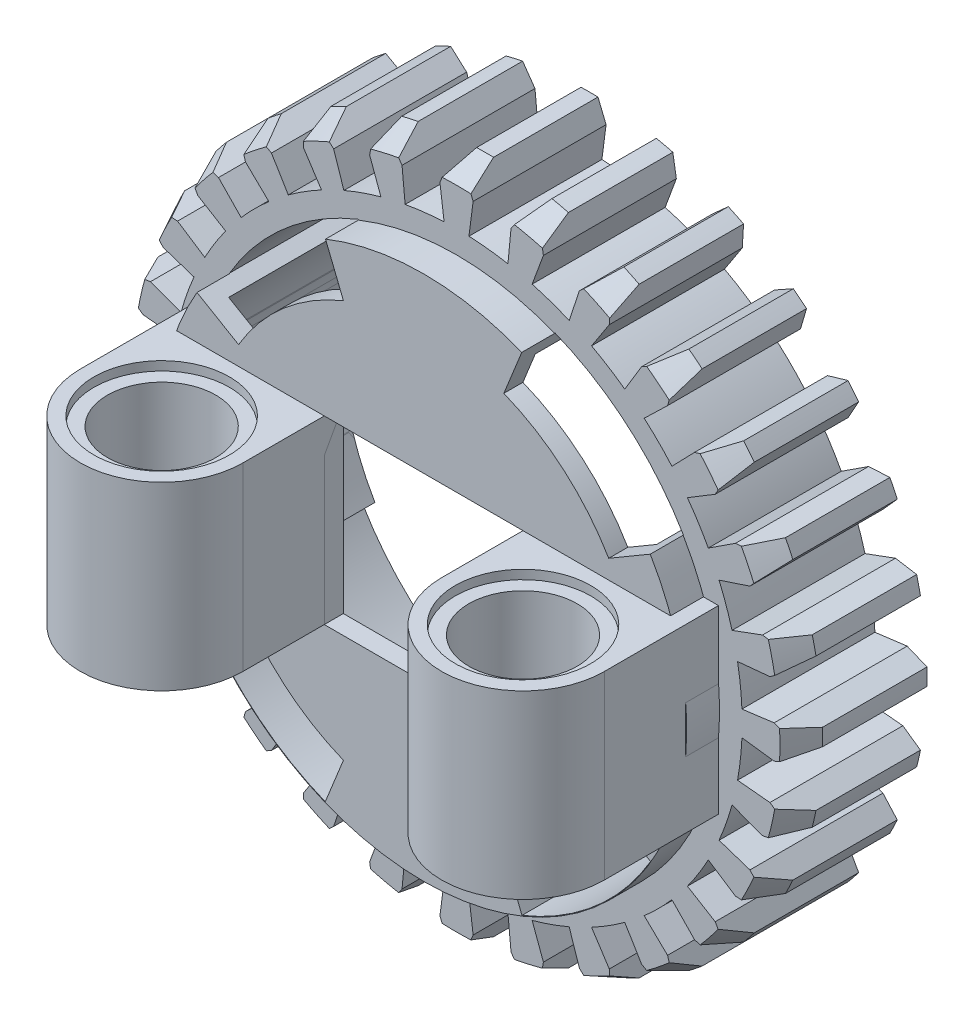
SolidWorks part; units mm, degrees
ref_plane "정면" through (0, 0, 0) normal (0, 0, 1) x (1, 0, 0)
ref_plane "윗면" through (0, 0, 0) normal (0, 1, 0) x (1, 0, 0)
ref_plane "우측면" through (0, 0, 0) normal (1, 0, 0) x (0, 0, -1)
imported_body "파트1-1-solid1"
imported_body "파트2-1-solid1"
imported_body "파트2-2-solid1"
sketch "스케치1" plane through (0, 0, 0) normal (0, 1, 0) x (1, 0, 0)
  line L1 (2.2178, -25.8675) -> (32.1384, -25.8675)
  line L2 (2.2178, -25.8675) -> (2.2178, -15.9648)
  line L3 (2.2178, -15.9648) -> (32.1384, -15.9648)
  line L4 (32.1384, -25.8675) -> (32.1384, -15.9648)
extrude "컷-돌출1" cut sketch "스케치1" against normal through all both and the other way through all
sketch "스케치2" plane through (0, 0, 0) normal (0, 0, 1) x (1, 0, 0)
  line L1 (12.7631, -5.8434) -> (21.5631, -5.8434)
  line L2 (12.7631, -5.8434) -> (12.7631, 2.1566)
  line L3 (12.7631, 2.1566) -> (21.5631, 2.1566)
  line L4 (21.5631, -5.8434) -> (21.5631, 2.1566)
  line L5 (12.7631, -5.8434) -> (21.5631, 2.1566) construction
  line L6 (12.7631, 2.1566) -> (21.5631, -5.8434) construction
  point P0 (17.1631, -1.8434)
  dimension "D1" = 8.8
  dimension "D2" = 8
extrude "컷-돌출2" cut sketch "스케치2" against normal through all both and the other way through all
ref_plane "평면1" through (17.1631, 0, 0) normal (1, 0, 0) x (0, 0, -1)
sketch "스케치4" plane through (17.1631, 0, 0) normal (1, 0, 0) x (0, 0, -1)
  line L0 (-30.0702, 13.3164) -> (-31.755, 12.4769)
  line L2 (-31.755, 11.7065) -> (-31.755, 12.6437) construction
  line L3 (-31.755, 12.4769) -> (-31.755, 13.3164)
  line L4 (-14.9575, -1.8434) -> (-45.8853, -1.8434) construction
  line L5 (-31.755, 13.3164) -> (-30.0702, 13.3164)
revolve "컷-회전1" cut sketch "스케치4" angle 360 about L4
sketch "스케치6" plane through (0, 0, 33.2113) normal (0, 0, 1) x (1, 0, 0)
  line L0 (17.1631, -1.8119) -> (17.1631, 14.0192) construction
  line L1 (17.1631, -4.0391) -> (17.1631, 4.0391) construction
  line L2 (0, -1.8119) -> (36.1478, -1.8119) construction
  line L3 (27.2122, 4.082) -> (25.3577, 2.9943)
  line L4 (20.7149, 6.9992) -> (21.5187, 8.9933)
  line L5 (7.114, 4.082) -> (8.9685, 2.9943)
  line L6 (13.6113, 6.9992) -> (12.8075, 8.9933)
  line L7 (27.2122, -7.7057) -> (25.3577, -6.618)
  line L8 (20.7149, -10.6229) -> (21.5187, -12.617)
  line L9 (7.114, -7.7057) -> (8.9685, -6.618)
  line L10 (13.6113, -10.6229) -> (12.8075, -12.617)
  arc A0 (25.3577, 2.9943) -> (20.7149, 6.9992) centre (17.1631, -1.8119) ccw
  arc A1 (7.114, 4.082) -> (12.8075, 8.9933) centre (17.1631, -1.8119) cw
  arc A3 (8.9685, 2.9943) -> (13.6113, 6.9992) centre (17.1631, -1.8119) cw
  arc A4 (27.2122, 4.082) -> (21.5187, 8.9933) centre (17.1631, -1.8119) ccw
  arc A5 (27.2122, -7.7057) -> (21.5187, -12.617) centre (17.1631, -1.8119) cw
  arc A6 (25.3577, -6.618) -> (20.7149, -10.6229) centre (17.1631, -1.8119) cw
  arc A7 (7.114, -7.7057) -> (12.8075, -12.617) centre (17.1631, -1.8119) ccw
  arc A8 (8.9685, -6.618) -> (13.6113, -10.6229) centre (17.1631, -1.8119) ccw
extrude "컷-돌출3" cut sketch "스케치6" against normal through all
sketch "스케치7" plane through (0, 0, 25.8675) normal (0, 0, -1) x (-1, 0, 0)
  circle A0 centre (-17.1631, -1.8434) radius 11
  dimension "D1" = 22
extrude "컷-돌출4" cut sketch "스케치7" against normal blind 6.5
